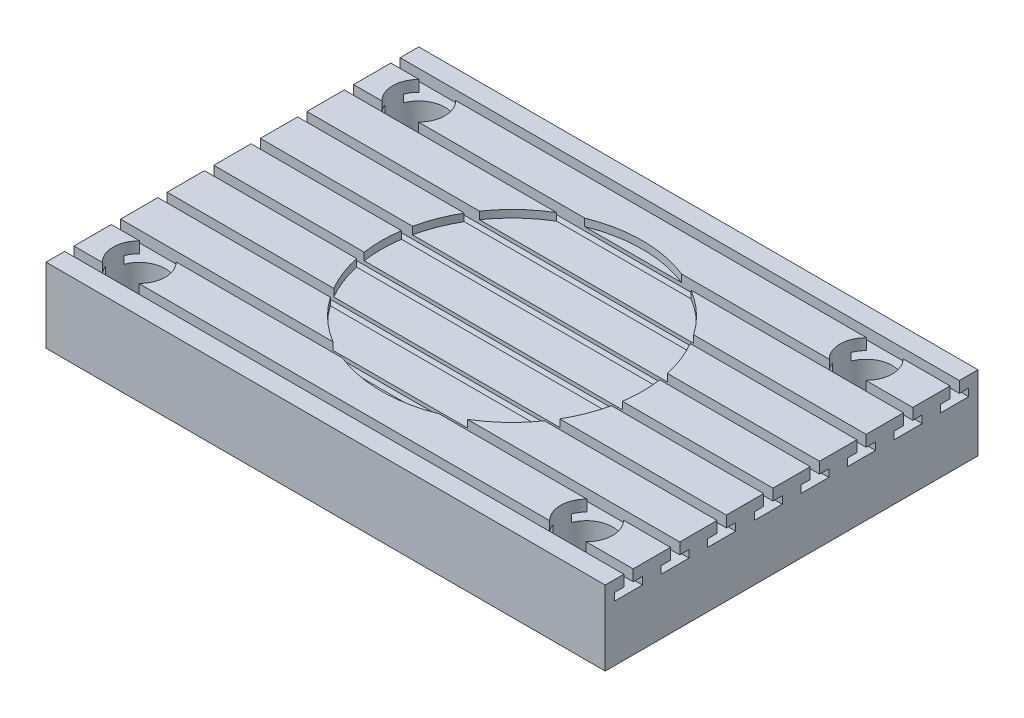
SolidWorks part; units mm, degrees
ref_plane "Front" through (0, 0, 0) normal (0, 0, 1) x (1, 0, 0)
ref_plane "Top" through (0, 0, 0) normal (0, 1, 0) x (1, 0, 0)
ref_plane "Right" through (0, 0, 0) normal (1, 0, 0) x (0, 0, -1)
sketch "Sketch1" plane through (0, 0, 0) normal (0, 1, 0) x (1, 0, 0)
  line L0 (75, -50) -> (-75, 50) construction
  line L1 (-75, 50) -> (75, 50)
  line L2 (-75, 50) -> (-75, -50)
  line L3 (-75, -50) -> (75, -50)
  line L4 (75, 50) -> (75, -50)
  dimension "D1" = 150
  dimension "D2" = 100
extrude "Boss-Extrude1" add sketch "Sketch1" along normal blind 20
hole_wizard "9/16 (0.562500) Diameter Hole1" positions "Sketch3" profile "Sketch2" hole size "9/16" standard "Ansi Inch"
sketch "Sketch3" plane through (0, 20, 0) normal (0, 1, 0) x (-1, 0, 0)
  line L0 (75, 50) -> (-75, 50) construction
  line L1 (75, -50) -> (75, 50) construction
  point P0 (62.5, 37.5)
  dimension "D1" = 12.5
  dimension "D2" = 12.5
sketch "Sketch2" plane through (-62.5, 20, 37.5) normal (1, 0, 0) x (0, 0, 1)
  line L0 (0, 0) -> (0, 20)
  line L1 (0, 20) -> (7, 20)
  line L2 (7, 20) -> (7, 0)
  line L5 (7, 0) -> (0, 0)
  line L11 (0, -6.35) -> (0, 107.95) construction
  dimension "Thru Hole Dia." = 14
  dimension "Thru Hole Depth" = 20
pattern_linear "LPattern1" count 2 spacing 120 along (1, 0, 0) count 2 spacing 75 along (0, 0, -1) of "9/16 (0.562500) Diameter Hole1"
sketch "Sketch4" plane through (75, 0, 0) normal (1, 0, 0) x (0, 0, -1)
  line L0 (-45, 20) -> (-45, 17)
  line L1 (-50, 20) -> (50, 20) construction
  line L2 (-45, 17) -> (-47.5, 17)
  line L3 (-47.5, 17) -> (-47.5, 15)
  line L4 (-47.5, 15) -> (-40, 15)
  line L5 (-40, 15) -> (-40, 17)
  line L6 (-40, 17) -> (-42.5, 17)
  line L7 (-42.5, 17) -> (-42.5, 20)
  line L8 (-42.5, 20) -> (-45, 20)
  line L9 (-43.75, 20) -> (-43.75, 15) construction
  line L10 (-50, 20) -> (-50, 0) construction
  dimension "D1" = 2.5
  dimension "D2" = 7.5
  dimension "D3" = 2
  dimension "D4" = 3
  dimension "D5" = 5
extrude "Cut-Extrude1" cut sketch "Sketch4" against normal through all
pattern_linear "LPattern2" count 8 spacing 12.5 along (0, 0, -1) of "Cut-Extrude1"
sketch "Sketch5" plane through (0, 20, 0) normal (0, 1, 0) x (-1, 0, 0)
  circle A0 centre (0, 0) radius 35
  dimension "D1" = 70
extrude "Cut-Extrude2" cut sketch "Sketch5" against normal blind 2
